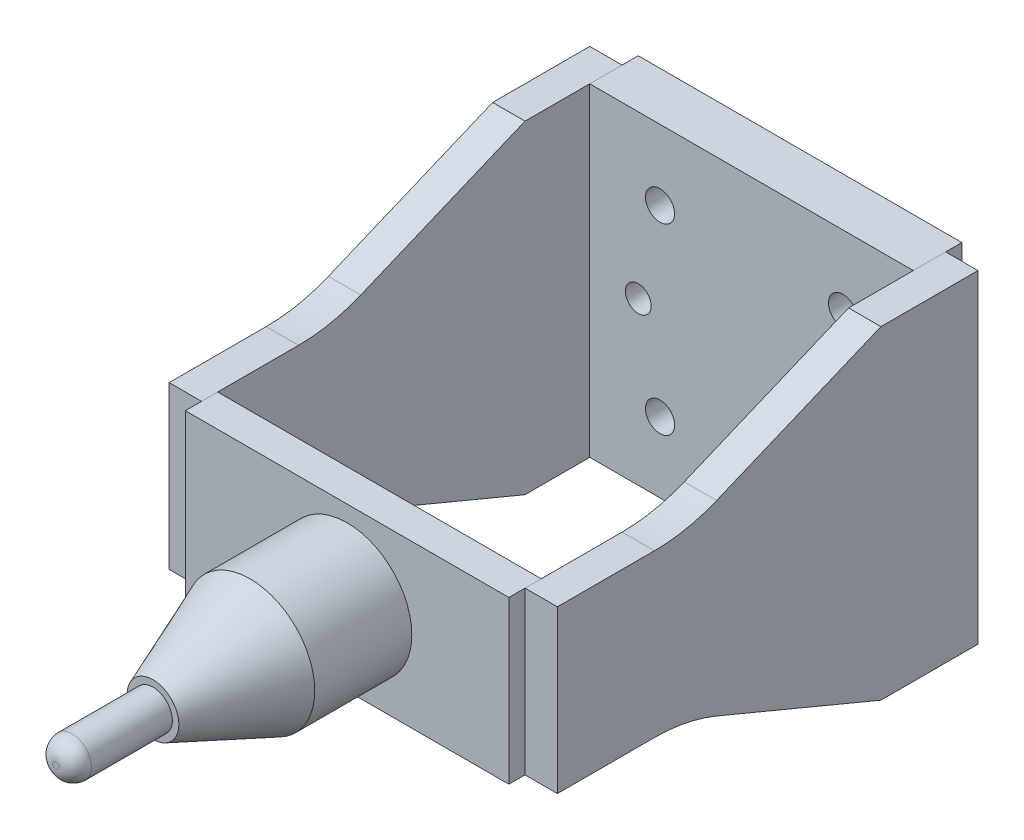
SolidWorks part; units mm, degrees
ref_plane "正面" through (0, 0, 0) normal (0, 0, 1) x (1, 0, 0)
ref_plane "平面" through (0, 0, 0) normal (0, 1, 0) x (1, 0, 0)
ref_plane "右側面" through (0, 0, 0) normal (1, 0, 0) x (0, 0, -1)
sketch "ｽｹｯﾁ1" plane through (0, 0, 0) normal (1, 0, 0) x (0, 0, -1)
  line L1 (-15, 50) -> (0, 50)
  line L2 (-15, 50) -> (-15, -50)
  line L3 (-15, -50) -> (0, -50)
  line L4 (0, 50) -> (0, -50)
  dimension "D1" = 100
  dimension "D2" = 15
extrude "ﾎﾞｽ - 押し出し1" add sketch "ｽｹｯﾁ1" along normal mid plane 100
sketch "ｽｹｯﾁ2" plane through (0, 0, 0) normal (0, 0, -1) x (-1, 0, 0)
  circle A0 centre (0, 0) radius 25
  dimension "D1" = 50
extrude "ﾎﾞｽ - 押し出し2" add sketch "ｽｹｯﾁ2" along normal blind 5
sketch "ｽｹｯﾁ3" plane through (50, 0, 0) normal (1, 0, 0) x (0, 0, -1)
  line L0 (-5, 50) -> (-5, -50)
  line L1 (-5, -50) -> (-35, -50)
  line L2 (-35, -50) -> (-95, -25)
  line L3 (-95, -25) -> (-135, -25)
  line L4 (-135, -25) -> (-135, 25)
  line L5 (-135, 25) -> (-95, 25)
  line L6 (-95, 25) -> (-35, 50)
  line L7 (-35, 50) -> (-5, 50)
  line L8 (0, 50) -> (-15, 50) construction
  line L9 (-15, -50) -> (0, -50) construction
  line L10 (0, -50) -> (0, 50) construction
  dimension "D1" = 5
  dimension "D2" = 130
  dimension "D3" = 30
  dimension "D4" = 60
  dimension "D5" = 50
extrude "ﾎﾞｽ - 押し出し3" add sketch "ｽｹｯﾁ3" along normal blind 10 separate body
fillet "ﾌｨﾚｯﾄ1" radius 50 2 edges at (55, -25, 95) (55, 25, 95)
sketch "ｽｹｯﾁ4" plane through (-50, 0, 0) normal (-1, 0, 0) x (0, 0, 1)
  line L8 (35, 50) -> (5, 50)
  line L9 (5, 50) -> (5, -50)
  line L10 (5, -50) -> (35, -50)
  line L11 (35, -50) -> (85.7692, -28.8462)
  line L12 (105, -25) -> (135, -25)
  line L13 (135, -25) -> (135, 25)
  line L14 (135, 25) -> (105, 25)
  line L15 (85.7692, 28.8462) -> (35, 50)
  line L16 (35, 50) -> (5, 50)
  line L17 (5, 50) -> (5, -50)
  line L18 (5, -50) -> (35, -50)
  line L19 (35, -50) -> (85.7692, -28.8462)
  line L20 (105, -25) -> (135, -25)
  line L21 (135, -25) -> (135, 25)
  line L22 (135, 25) -> (105, 25)
  line L23 (85.7692, 28.8462) -> (35, 50)
  arc A2 (105, -25) -> (85.7692, -28.8462) centre (105, -75) ccw
  arc A3 (85.7692, 28.8462) -> (105, 25) centre (105, 75) ccw
  arc A4 (105, -25) -> (85.7692, -28.8462) centre (105, -75) ccw
  arc A5 (85.7692, 28.8462) -> (105, 25) centre (105, 75) ccw
  dimension "D1" = 0
extrude "ﾎﾞｽ - 押し出し4" add sketch "ｽｹｯﾁ4" along normal blind 10 separate body
sketch "ｽｹｯﾁ5" plane through (0, 0, 0) normal (1, 0, 0) x (0, 0, -1)
  line L0 (-135, -25) -> (-105, -25) construction
  line L1 (-140, 25) -> (-130, 25)
  line L2 (-140, 25) -> (-140, -25)
  line L3 (-140, -25) -> (-130, -25)
  line L4 (-130, 25) -> (-130, -25)
  line L5 (-105, 25) -> (-135, 25) construction
  line L6 (0, -50) -> (0, 50) construction
  dimension "D1" = 10
  dimension "D2" = 140
extrude "ﾎﾞｽ - 押し出し5" add sketch "ｽｹｯﾁ5" against normal up to surface and the other way up to surface separate body
sketch "ｽｹｯﾁ6" plane through (0, 0, 0) normal (1, 0, 0) x (0, 0, -1)
  line L0 (-140, 20) -> (-140, 0)
  line L1 (-140, 0) -> (-200, 0)
  line L2 (-200, 0) -> (-200, 8)
  line L3 (-200, 8) -> (-170, 20)
  line L4 (-170, 20) -> (-140, 20)
  line L5 (-140, -25) -> (-140, 25) construction
  line L6 (-140, 0) -> (0, 0) construction
  dimension "D1" = 30
  dimension "D2" = 60
  dimension "D3" = 16
  dimension "D4" = 40
revolve "回転1" add sketch "ｽｹｯﾁ6" angle 360 about L6
sketch "ｽｹｯﾁ7" plane through (0, 0, 200) normal (0, 0, 1) x (1, 0, 0)
  circle A0 centre (0, 0) radius 6
  dimension "D1" = 12
extrude "ﾎﾞｽ - 押し出し6" add sketch "ｽｹｯﾁ7" along normal blind 30 separate body
fillet "ﾌｨﾚｯﾄ2" radius 5 1 edges at (6, 0, 230)
sketch "ｽｹｯﾁ8" plane through (0, 0, 0) normal (0, 0, -1) x (-1, 0, 0)
  line L0 (-35, 0) -> (35, 0) construction
  circle A0 centre (35, 0) radius 4
  circle A1 centre (-35, 0) radius 4
  point P4 (0, 0)
  dimension "D2" = 8
  dimension "D1" = 70
extrude "ｶｯﾄ - 押し出し1" cut sketch "ｽｹｯﾁ8" against normal up to next
hole_wizard "Ø9.0 (9) 直径の穴1" positions "ｽｹｯﾁ9" profile "ｽｹｯﾁ11" hole size "Ø9.0" standard "JIS"
sketch "ｽｹｯﾁ9" plane through (0, 0, 0) normal (0, 0, -1) x (-1, 0, 0)
  line L0 (-28.2843, 28.2843) -> (0, 0)
  line L1 (0, 0) -> (-40, 0)
  circle A0 centre (0, 0) radius 40
  point P0 (-28.2843, 28.2843)
  dimension "D1" = 80
  dimension "D2" = 45
sketch "ｽｹｯﾁ11" plane through (28.2843, 28.2843, 0) normal (1, 0, 0) x (0, 1, 0)
  line L0 (0, 0) -> (0, 15.001)
  line L1 (0, 15.001) -> (4.5, 15.001)
  line L2 (4.5, 15.001) -> (4.5, 0)
  line L5 (4.5, 0) -> (0, 0)
  line L11 (0, -6.35) -> (0, 107.95) construction
  dimension "通し穴の直径" = 9
  dimension "通し穴の深さ" = 15.001
pattern_circular "円形ﾊﾟﾀｰﾝ1" count 4 over 360 about axis through (0, 0, 0) along (0, 0, 1) of "Ø9.0 (9) 直径の穴1"
hole_wizard "Ø10.0 (10) 直径の穴1" positions "ｽｹｯﾁ12" profile "ｽｹｯﾁ14" hole size "Ø10.0" standard "JIS"
sketch "ｽｹｯﾁ12" plane through (0, 0, 130) normal (0, 0, -1) x (-1, 0, 0)
  point P0 (0, 0)
sketch "ｽｹｯﾁ14" plane through (0, 0, 130) normal (1, 0, 0) x (0, 1, 0)
  line L0 (0, 0) -> (0, 33.0043)
  line L1 (0, 33.0043) -> (5, 30)
  line L2 (5, 30) -> (5, 0)
  line L5 (5, 0) -> (0, 0)
  line L10 (0, 33.0043) -> (-5, 30) construction
  line L11 (0, -6.35) -> (0, 107.95) construction
  dimension "穴の直径" = 10
  dimension "穴の深さ" = 30
  dimension "ﾄﾞﾘﾙ角度" = 118
